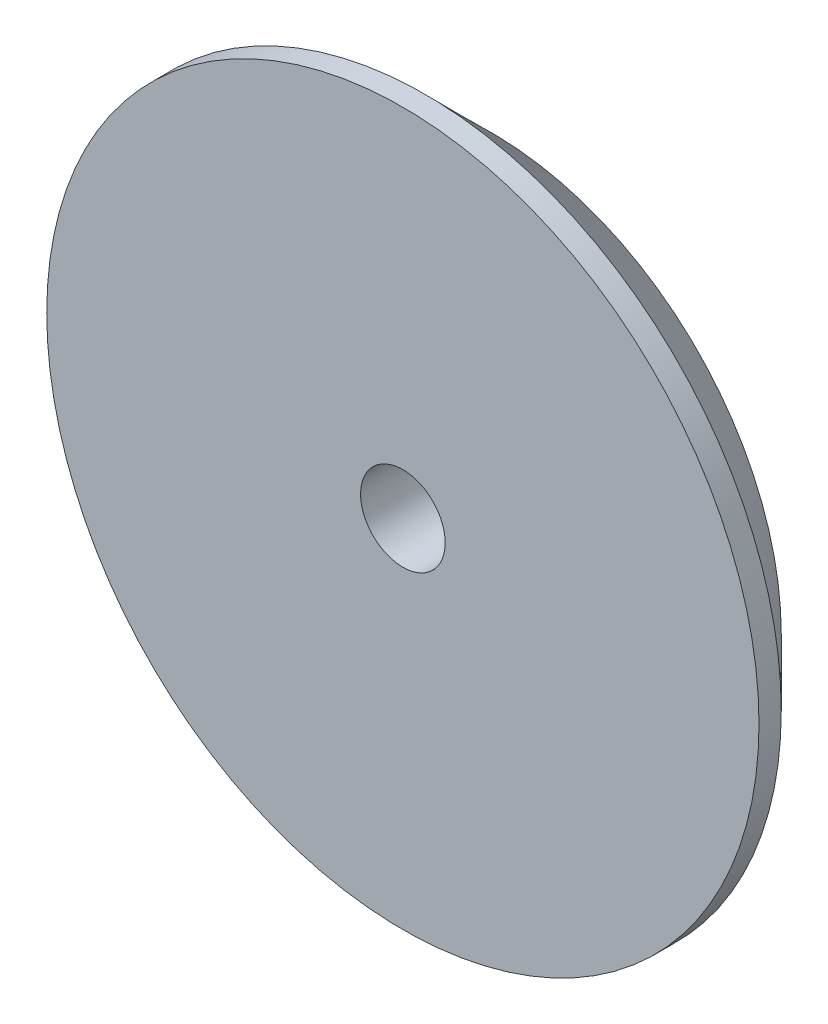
SolidWorks part; units mm, degrees
ref_plane "Plan de face" through (0, 0, 0) normal (0, 0, 1) x (1, 0, 0)
ref_plane "Plan de dessus" through (0, 0, 0) normal (0, 1, 0) x (1, 0, 0)
ref_plane "Plan de droite" through (0, 0, 0) normal (1, 0, 0) x (0, 0, -1)
sketch "Esquisse1" plane through (0, 0, 0) normal (0, 0, 1) x (1, 0, 0)
  circle A0 centre (0, 0) radius 0.95
  circle A1 centre (0, 0) radius 8
extrude "Extrusion1" add sketch "Esquisse1" along normal blind 2
chamfer "Chanfrein1" distance 1.5 distance2 1.5 1 edges at (8, 0, 0)
